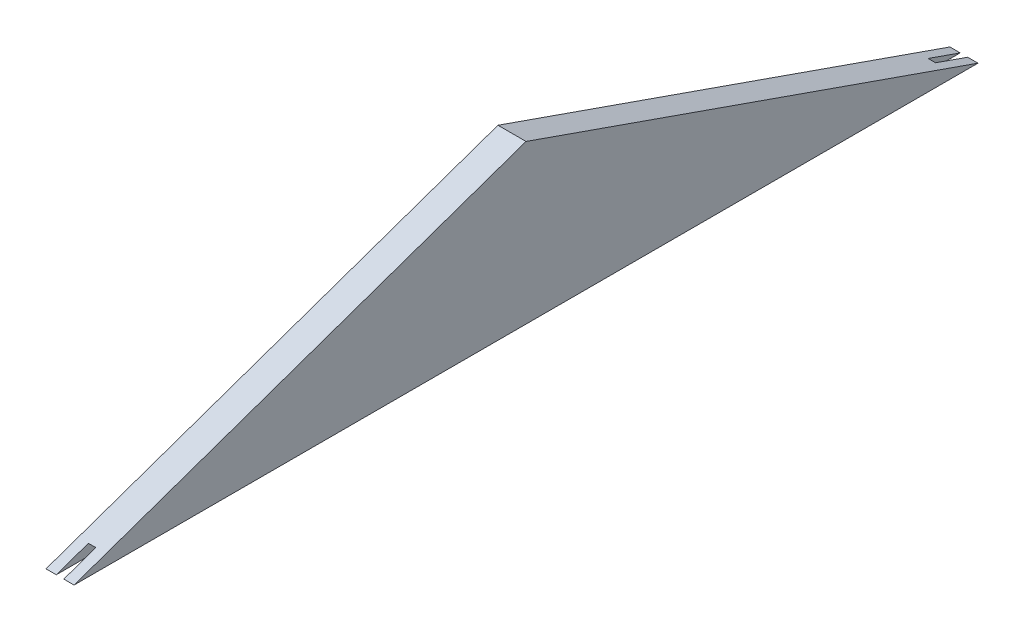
SolidWorks part; units mm, degrees
ref_plane "Plan de face" through (0, 0, 0) normal (0, 0, 1) x (1, 0, 0)
ref_plane "Plan de dessus" through (0, 0, 0) normal (0, 1, 0) x (1, 0, 0)
ref_plane "Plan de droite" through (0, 0, 0) normal (1, 0, 0) x (0, 0, -1)
sketch "Esquisse1" plane through (0, 0, 0) normal (0, 0, 1) x (1, 0, 0)
  line L1 (-7.5, 43.5) -> (7.5, 43.5)
  line L2 (-7.5, 43.5) -> (-7.5, -43.5)
  line L3 (-7.5, -43.5) -> (7.5, -43.5)
  line L4 (7.5, 43.5) -> (7.5, -43.5)
  line L5 (-7.5, 43.5) -> (7.5, -43.5) construction
  line L6 (-7.5, -43.5) -> (7.5, 43.5) construction
  line L7 (-2, 35.5) -> (2, 35.5)
  line L8 (-2, 35.5) -> (-2, 51.5)
  line L9 (-2, 51.5) -> (2, 51.5)
  line L10 (2, 35.5) -> (2, 51.5)
  line L11 (-2, 35.5) -> (2, 51.5) construction
  line L12 (-2, 51.5) -> (2, 35.5) construction
  line L13 (-2, -37.5) -> (2, -37.5)
  line L14 (-2, -37.5) -> (-2, -49.5)
  line L15 (-2, -49.5) -> (2, -49.5)
  line L16 (2, -37.5) -> (2, -49.5)
  line L17 (-2, -37.5) -> (2, -49.5) construction
  line L18 (-2, -49.5) -> (2, -37.5) construction
  point P0 (0, 0)
  point P5 (0, 43.5)
  point P11 (0, -43.5)
  dimension "D1" = 87
  dimension "D2" = 15
  dimension "D3" = 4
  dimension "D4" = 16
  dimension "D5" = 12
extrude "Boss.-Extru.1" add sketch "Esquisse1" along normal blind 482.9 contours L1 L10 L9 L8 | L7 L10 L1 L8 | L13 L16 L3 L4 L1 L10 L7 L8 L2 L14
sketch "Esquisse2" plane through (0, 0, 0) normal (1, 0, 0) x (0, 0, -1)
  line L0 (-482.9, -43.5) -> (0, -43.5) construction
  line L1 (-482.9, -43.5) -> (-384.7448, -9.1458)
  line L2 (-384.7448, -9.1458) -> (-385.0574, -9.3431)
  line L3 (-482.9, -43.5) -> (-211.4707, 51.5)
  line L4 (-482.9, 51.5) -> (0, 51.5) construction
  line L5 (-211.4707, 51.5) -> (-482.9, 51.5)
  line L6 (-482.9, 51.5) -> (-482.9, -43.5)
  line L7 (0, -43.5) -> (-101.7468, -7.8887)
  line L8 (0, -43.5) -> (-271.4293, 51.5)
  line L9 (-271.4293, 51.5) -> (0, 51.5)
  line L10 (0, 51.5) -> (0, -43.5)
  arc A0 (-378.9065, -43.5) -> (-384.7448, -9.1458) centre (-482.9, -43.5) ccw
  arc A1 (-107.7987, -43.5) -> (-101.7468, -7.8887) centre (0, -43.5) cw
extrude "Enlèv. mat.-Extru.1" cut sketch "Esquisse2" against normal through all both and the other way through all contours L3 L5 L6 | L8 L9 L10
